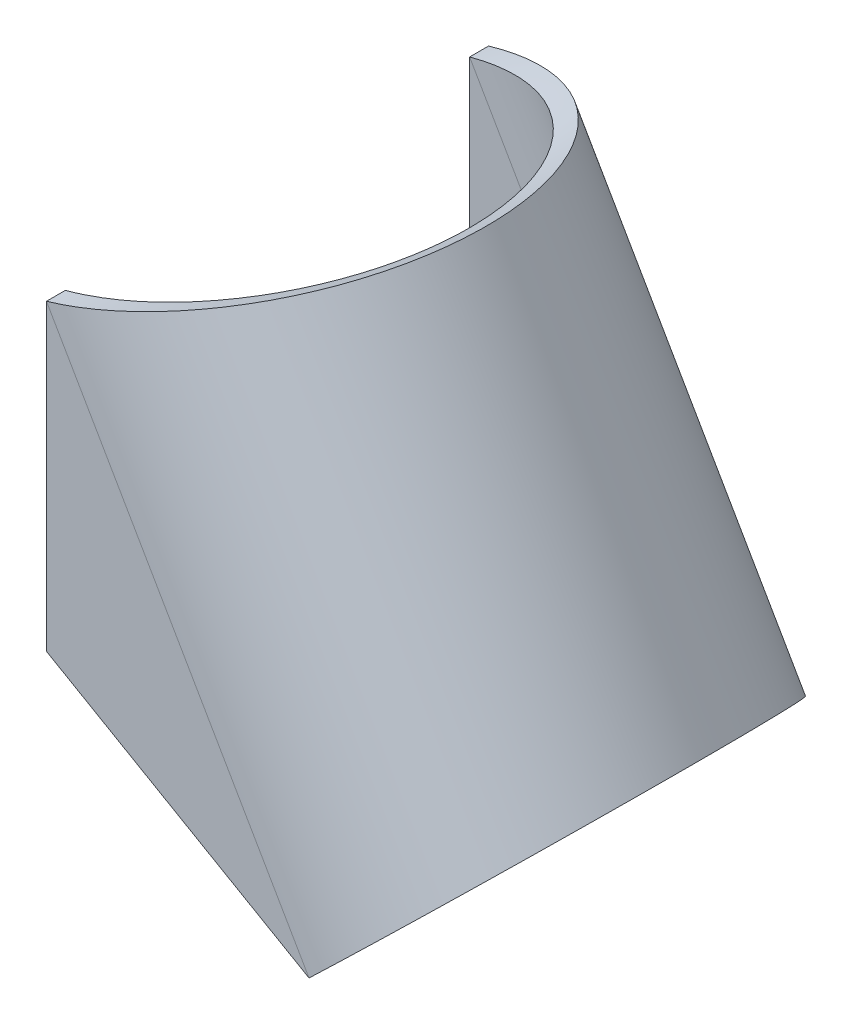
SolidWorks part; units mm, degrees
ref_plane "前视基准面" through (0, 0, 0) normal (0, 0, 1) x (1, 0, 0)
ref_plane "上视基准面" through (0, 0, 0) normal (0, 1, 0) x (1, 0, 0)
ref_plane "右视基准面" through (0, 0, 0) normal (1, 0, 0) x (0, 0, -1)
imported_body "基体零件-带补料的120°Y形三通管-1"
sheet metal parameters "钣金1" parameters "D1"=0.7366, "厚度"=1
bend "圆角折弯1" bend radius 10.6658 bend angle 180 parameters "D5"=1
flatten bends "展开-折弯1"
sketch "尖角-草图1" plane through (0, 0, -10.6658) normal (0, 0, 1) x (1, 0, 0)
  line L0 (28.3657, 0.3769) -> (14.5093, 24.3769) construction
  dimension "D1" = 0
process bends "加工-折弯1" parameters "D1"=0
sketch "平面-草图1" plane through (0, 0, -10.6658) normal (0, 0, 1) x (1, 0, 0)
flat pattern "平板型式1"
sketch "折弯-线1" plane through (0, 0, 0) normal (0, 1, 0) x (-1, 0, 0)
bend of the flat pattern "展开-<圆角折弯1>1"
